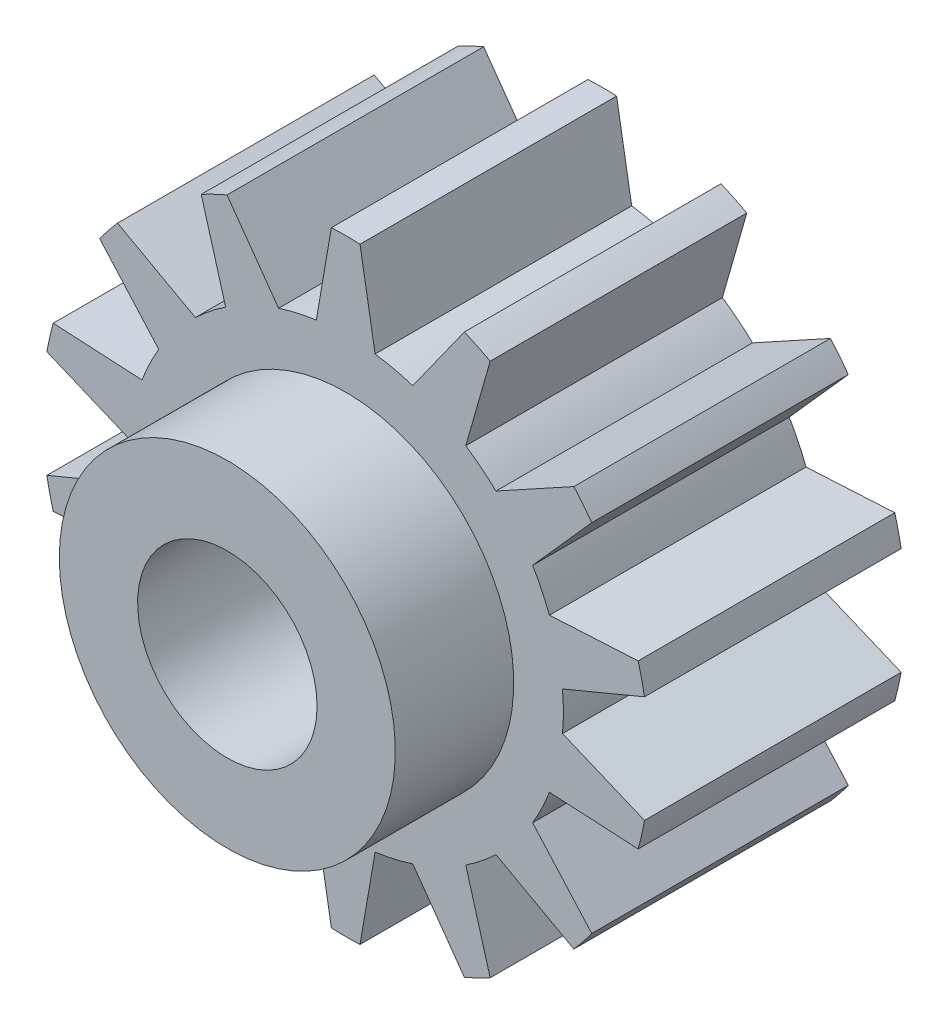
SolidWorks part; units mm, degrees
ref_plane "Plane1" through (0, 0, 0) normal (0, 0, 1) x (1, 0, 0)
ref_plane "Plane2" through (0, 0, 0) normal (0, 1, 0) x (1, 0, 0)
ref_plane "Plane3" through (0, 0, 0) normal (1, 0, 0) x (0, 0, -1)
sketch "Sketch1" plane through (0, 0, 0) normal (0, 0, 1) x (1, 0, 0)
  line L0 (0, 10.9008) -> (0, -10.045) construction
  circle A1 centre (0, 0) radius 5.7
  dimension "D1" = 11.4
extrude "motor gear shape" add sketch "Sketch1" along normal blind 6.72
sketch "Sketch2" plane through (0, 0, 6.72) normal (0, 0, 1) x (1, 0, 0)
  line L0 (0, 9.1728) -> (0, -9.6432) construction
  line L1 (0.375, 7.9412) -> (0.77, 5.6478)
  line L2 (-0.375, 7.9412) -> (-0.77, 5.6478)
  arc A0 (0.375, 7.9412) -> (-0.375, 7.9412) centre (0, 0) ccw
  circle A1 centre (0, 0) radius 5.7 construction
  arc A2 (0.77, 5.6478) -> (-0.77, 5.6478) centre (0, 0) ccw
  dimension "D1" = 15.9
  dimension "D2" = 0.75
  dimension "D3" = 1.54
extrude "motor gear tooth" add sketch "Sketch2" along normal up to surface (6.72 mm away)
pattern_circular "motor gear teeth " count 14 every 25.714
sketch "Sketch3" plane through (0, 0, 6.72) normal (0, 0, 1) x (1, 0, 0)
  circle A0 centre (0, 0) radius 4.4
  circle A1 centre (0, 0) radius 2.35
  dimension "D1" = 8.8
  dimension "D2" = 4.7
extrude "motor gear boss" add sketch "Sketch3" along normal blind 3.1
sketch "Sketch4" plane through (0, 0, 9.82) normal (0, 0, 1) x (1, 0, 0)
  circle A0 centre (0, 0) radius 2.35 construction
  circle A1 centre (0, 0) radius 2.35
extrude "motor shaft hole" cut sketch "Sketch4" against normal through all
sketch "Sketch5" plane through (0, 0, 0) normal (0, 0, -1) x (-1, 0, 0)
  line L0 (-3.1081, -1.25) -> (3.1081, -1.25)
  circle A2 centre (0, 0) radius 3.35
  arc A3 (-3.1081, -1.25) -> (3.1081, -1.25) centre (0, 0) ccw
  circle A4 centre (0, 0) radius 2.35 construction
  dimension "D1" = 1
  dimension "D2" = 3.6
extrude "motor shaft flat" add sketch "Sketch5" against normal blind 4.9
